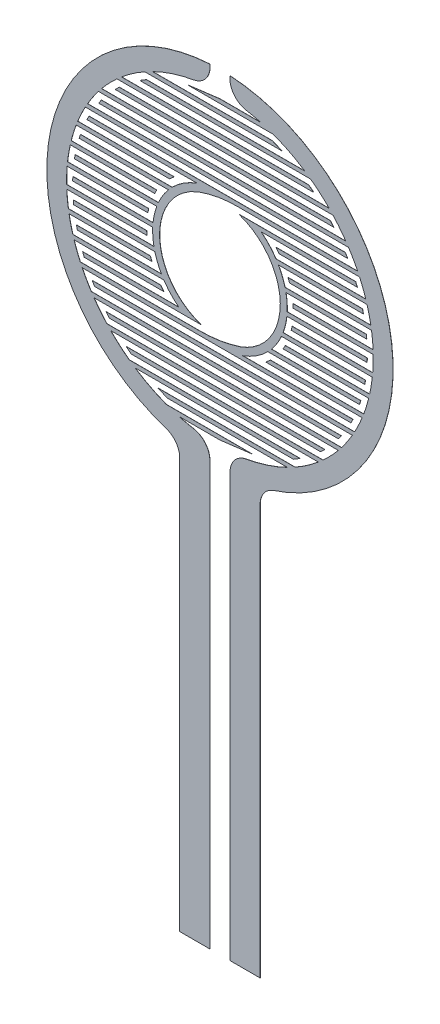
SolidWorks part; units mm, degrees
ref_plane "Front Plane" through (0, 0, 0) normal (0, 0, 1) x (1, 0, 0)
ref_plane "Top Plane" through (0, 0, 0) normal (0, 1, 0) x (1, 0, 0)
ref_plane "Right Plane" through (0, 0, 0) normal (1, 0, 0) x (0, 0, -1)
sketch "Sketch1" plane through (0, 0, 0) normal (0, 0, 1) x (1, 0, 0)
  line L0 (-1.0555, -3.2004) -> (-7.0583, -3.2004)
  line L557 (-0.508, -29.9998) -> (-0.508, -8.6191)
  line L558 (-2.0737, -7.4674) -> (0, -7.4674)
  line L559 (0, -7.4674) -> (1.6299, -7.2644)
  line L560 (1.6299, -7.2644) -> (-2.7002, -7.2644)
  line L561 (-4.2944, -6.4514) -> (3.7158, -6.4514)
  line L562 (4.0479, -6.2484) -> (-4.5848, -6.2484)
  line L563 (-5.5244, -5.4354) -> (5.0877, -5.4354)
  line L564 (5.2962, -5.2324) -> (-5.717, -5.2324)
  line L565 (-6.3664, -4.4194) -> (5.9914, -4.4194)
  line L566 (6.136, -4.2164) -> (-6.5027, -4.2164)
  line L567 (-6.9627, -3.4034) -> (6.6215, -3.4034)
  line L568 (6.6215, -3.4034) -> (6.722, -3.2004)
  line L569 (6.722, -3.2004) -> (1.1478, -3.2004)
  line L570 (2.4208, -2.3874) -> (7.0518, -2.3874)
  line L571 (7.0518, -2.3874) -> (7.1173, -2.1844)
  line L572 (7.1173, -2.1844) -> (2.6055, -2.1844)
  line L573 (3.1112, -1.3714) -> (7.3176, -1.3714)
  line L574 (7.3176, -1.3714) -> (7.3527, -1.1684)
  line L575 (7.3527, -1.1684) -> (3.1929, -1.1684)
  line L576 (3.3814, -0.3554) -> (7.4365, -0.3554)
  line L577 (7.4365, -0.3554) -> (7.4434, -0.1524)
  line L578 (7.4434, -0.1524) -> (3.3966, -0.1524)
  line L579 (3.3352, 0.6604) -> (7.4157, 0.6604)
  line L580 (7.4157, 0.6604) -> (7.3948, 0.8634)
  line L581 (7.3948, 0.8634) -> (3.2885, 0.8634)
  line L582 (2.958, 1.6764) -> (7.2538, 1.6764)
  line L583 (7.2538, 1.6764) -> (7.2039, 1.8794)
  line L584 (7.2039, 1.8794) -> (2.8333, 1.8794)
  line L585 (2.0763, 2.6924) -> (6.9411, 2.6924)
  line L586 (6.9411, 2.6924) -> (6.8589, 2.8954)
  line L587 (6.8589, 2.8954) -> (0.9587, 2.8954)
  line L590 (-7.3731, -2.3874) -> (-2.8333, -2.3874)
  line L591 (-2.9926, -2.1844) -> (-7.4358, -2.1844)
  line L592 (-7.6277, -1.3714) -> (-3.4418, -1.3714)
  line L593 (-3.5159, -1.1684) -> (-7.6614, -1.1684)
  line L594 (-7.7418, -0.3554) -> (-3.6879, -0.3554)
  line L595 (-3.7019, -0.1524) -> (-7.7485, -0.1524)
  line L596 (-7.7218, 0.6604) -> (-3.6457, 0.6604)
  line L597 (-3.603, 0.8634) -> (-7.7018, 0.8634)
  line L598 (-7.5665, 1.6764) -> (-3.304, 1.6764)
  line L599 (-3.1929, 1.8794) -> (-7.5187, 1.8794)
  line L600 (-7.2673, 2.6924) -> (-2.5452, 2.6924)
  line L601 (-2.3116, 2.8954) -> (-7.1888, 2.8954)
  line L602 (-6.8052, 3.7084) -> (6.4557, 3.7084)
  line L603 (6.4557, 3.7084) -> (6.3347, 3.9114)
  line L604 (6.3347, 3.9114) -> (-6.6905, 3.9114)
  line L605 (-6.1435, 4.7244) -> (5.754, 4.7244)
  line L606 (5.5811, 4.9274) -> (-5.9819, 4.9274)
  line L607 (-5.2068, 5.7404) -> (4.7409, 5.7404)
  line L608 (4.4838, 5.9434) -> (-4.9738, 5.9434)
  line L609 (-3.7965, 6.7564) -> (3.1272, 6.7564)
  line L610 (2.6448, 6.9594) -> (-3.4102, 6.9594)
  line L611 (-0.5, 8.6205) -> (-0.5, 8.7357)
  line L612 (-2.032, -9.2666) -> (-2.032, -29.9998)
  line L613 (-2.032, -29.9998) -> (-0.508, -29.9998)
  line L614 (0.508, -29.9998) -> (0.508, -8.6191)
  line L615 (3.4102, -6.9594) -> (-2.6448, -6.9594)
  line L616 (-3.1272, -6.7564) -> (3.7965, -6.7564)
  line L617 (4.9738, -5.9434) -> (-4.4838, -5.9434)
  line L618 (-4.7409, -5.7404) -> (5.2068, -5.7404)
  line L619 (5.9819, -4.9274) -> (-5.5811, -4.9274)
  line L620 (-5.754, -4.7244) -> (6.1435, -4.7244)
  line L621 (6.6905, -3.9114) -> (-6.3347, -3.9114)
  line L622 (-6.3347, -3.9114) -> (-6.4557, -3.7084)
  line L623 (-6.4557, -3.7084) -> (6.8052, -3.7084)
  line L624 (7.1888, -2.8954) -> (2.3116, -2.8954)
  line L625 (2.5452, -2.6924) -> (7.2673, -2.6924)
  line L626 (7.5187, -1.8794) -> (3.1929, -1.8794)
  line L627 (3.304, -1.6764) -> (7.5665, -1.6764)
  line L628 (7.7018, -0.8634) -> (3.603, -0.8634)
  line L629 (3.6457, -0.6604) -> (7.7218, -0.6604)
  line L630 (7.7485, 0.1524) -> (3.7019, 0.1524)
  line L631 (3.6879, 0.3554) -> (7.7418, 0.3554)
  line L632 (7.6614, 1.1684) -> (3.5159, 1.1684)
  line L633 (3.4418, 1.3714) -> (7.6277, 1.3714)
  line L634 (7.4358, 2.1844) -> (2.9926, 2.1844)
  line L635 (2.8333, 2.3874) -> (7.3731, 2.3874)
  line L636 (7.0583, 3.2004) -> (0.9587, 3.2004)
  line L637 (-0.9587, -2.8954) -> (-6.8589, -2.8954)
  line L638 (-6.8589, -2.8954) -> (-6.9411, -2.6924)
  line L639 (-6.9411, -2.6924) -> (-2.0763, -2.6924)
  line L640 (-2.8333, -1.8794) -> (-7.2039, -1.8794)
  line L641 (-7.2039, -1.8794) -> (-7.2538, -1.6764)
  line L642 (-7.2538, -1.6764) -> (-2.958, -1.6764)
  line L643 (-3.2885, -0.8634) -> (-7.3948, -0.8634)
  line L644 (-7.3948, -0.8634) -> (-7.4157, -0.6604)
  line L645 (-7.4157, -0.6604) -> (-3.3352, -0.6604)
  line L646 (-3.3966, 0.1524) -> (-7.4434, 0.1524)
  line L647 (-7.4434, 0.1524) -> (-7.4365, 0.3554)
  line L648 (-7.4365, 0.3554) -> (-3.3814, 0.3554)
  line L649 (-3.1929, 1.1684) -> (-7.3527, 1.1684)
  line L650 (-7.3527, 1.1684) -> (-7.3176, 1.3714)
  line L651 (-7.3176, 1.3714) -> (-3.1112, 1.3714)
  line L652 (-2.6055, 2.1844) -> (-7.1173, 2.1844)
  line L653 (-7.1173, 2.1844) -> (-7.0518, 2.3874)
  line L654 (-7.0518, 2.3874) -> (-2.4208, 2.3874)
  line L655 (-1.1478, 3.2004) -> (-6.722, 3.2004)
  line L656 (-6.722, 3.2004) -> (-6.6215, 3.4034)
  line L657 (-6.6215, 3.4034) -> (6.9627, 3.4034)
  line L658 (6.5027, 4.2164) -> (-6.136, 4.2164)
  line L659 (-5.9914, 4.4194) -> (6.3664, 4.4194)
  line L660 (5.717, 5.2324) -> (-5.2962, 5.2324)
  line L661 (-5.0877, 5.4354) -> (5.5244, 5.4354)
  line L662 (4.5848, 6.2484) -> (-4.0479, 6.2484)
  line L663 (-3.7158, 6.4514) -> (4.2944, 6.4514)
  line L664 (2.7002, 7.2644) -> (-1.6299, 7.2644)
  line L665 (-1.6299, 7.2644) -> (0, 7.4674)
  line L666 (0, 7.4674) -> (2.0737, 7.4674)
  line L667 (0.5, 8.6205) -> (0.5, 8.7357)
  line L668 (2.032, -9.2666) -> (2.032, -29.9998)
  line L669 (2.032, -29.9998) -> (0.508, -29.9998)
  arc A177 (-0.508, -8.6191) -> (-1.3357, -7.634) centre (-1.508, -8.6191) ccw
  arc A178 (-2.0737, -7.4674) -> (-1.3357, -7.634) centre (0, 0) ccw
  arc A179 (-4.2944, -6.4514) -> (-2.7002, -7.2644) centre (0, 0) ccw
  arc A180 (3.7158, -6.4514) -> (4.0479, -6.2484) centre (0, 0) ccw
  arc A181 (-5.5244, -5.4354) -> (-4.5848, -6.2484) centre (0, 0) ccw
  arc A182 (5.0877, -5.4354) -> (5.2962, -5.2324) centre (0, 0) ccw
  arc A183 (-6.3664, -4.4194) -> (-5.717, -5.2324) centre (0, 0) ccw
  arc A184 (5.9914, -4.4194) -> (6.136, -4.2164) centre (0, 0) ccw
  arc A185 (-6.9627, -3.4034) -> (-6.5027, -4.2164) centre (0, 0) ccw
  arc A186 (1.1478, -3.2004) -> (2.4208, -2.3874) centre (0, 0) ccw
  arc A187 (2.6055, -2.1844) -> (3.1112, -1.3714) centre (0, 0) ccw
  arc A188 (3.1929, -1.1684) -> (3.3814, -0.3554) centre (0, 0) ccw
  arc A189 (3.3966, -0.1524) -> (3.3352, 0.6604) centre (0, 0) ccw
  arc A190 (3.2885, 0.8634) -> (2.958, 1.6764) centre (0, 0) ccw
  arc A191 (2.8333, 1.8794) -> (2.0763, 2.6924) centre (0, 0) ccw
  arc A192 (1.0296, -2.8709) -> (0.9587, 2.8954) centre (0, 0) ccw
  arc A193 (-1.0555, -3.2004) -> (1.0296, -2.8709) centre (-1.0071, 3.2566) ccw
  arc A194 (-7.3731, -2.3874) -> (-7.0583, -3.2004) centre (0, 0) ccw
  arc A195 (-2.9926, -2.1844) -> (-2.8333, -2.3874) centre (0, 0) ccw
  arc A196 (-7.6277, -1.3714) -> (-7.4358, -2.1844) centre (0, 0) ccw
  arc A197 (-3.5159, -1.1684) -> (-3.4418, -1.3714) centre (0, 0) ccw
  arc A198 (-7.7418, -0.3554) -> (-7.6614, -1.1684) centre (0, 0) ccw
  arc A199 (-3.7019, -0.1524) -> (-3.6879, -0.3554) centre (0, 0) ccw
  arc A200 (-7.7218, 0.6604) -> (-7.7485, -0.1524) centre (0, 0) ccw
  arc A201 (-3.603, 0.8634) -> (-3.6457, 0.6604) centre (0, 0) ccw
  arc A202 (-7.5665, 1.6764) -> (-7.7018, 0.8634) centre (0, 0) ccw
  arc A203 (-3.1929, 1.8794) -> (-3.304, 1.6764) centre (0, 0) ccw
  arc A204 (-7.2673, 2.6924) -> (-7.5187, 1.8794) centre (0, 0) ccw
  arc A205 (-2.3116, 2.8954) -> (-2.5452, 2.6924) centre (0, 0) ccw
  arc A206 (-6.8052, 3.7084) -> (-7.1888, 2.8954) centre (0, 0) ccw
  arc A207 (-6.1435, 4.7244) -> (-6.6905, 3.9114) centre (0, 0) ccw
  arc A208 (5.754, 4.7244) -> (5.5811, 4.9274) centre (0, 0) ccw
  arc A209 (-5.2068, 5.7404) -> (-5.9819, 4.9274) centre (0, 0) ccw
  arc A210 (4.7409, 5.7404) -> (4.4838, 5.9434) centre (0, 0) ccw
  arc A211 (-3.7965, 6.7564) -> (-4.9738, 5.9434) centre (0, 0) ccw
  arc A212 (3.1272, 6.7564) -> (2.6448, 6.9594) centre (0, 0) ccw
  arc A213 (-1.3286, 7.6353) -> (-3.4102, 6.9594) centre (0, 0) ccw
  arc A214 (-1.3286, 7.6353) -> (-0.5, 8.6205) centre (-1.5, 8.6205) ccw
  arc A215 (-0.5, 8.7357) -> (-2.721, -8.3162) centre (0, 0) ccw
  arc A216 (-2.032, -9.2666) -> (-2.721, -8.3162) centre (-3.032, -9.2666) ccw
  arc A217 (1.3357, -7.634) -> (0.508, -8.6191) centre (1.508, -8.6191) ccw
  arc A218 (1.3357, -7.634) -> (3.4102, -6.9594) centre (0, 0) ccw
  arc A219 (-3.1272, -6.7564) -> (-2.6448, -6.9594) centre (0, 0) ccw
  arc A220 (3.7965, -6.7564) -> (4.9738, -5.9434) centre (0, 0) ccw
  arc A221 (-4.7409, -5.7404) -> (-4.4838, -5.9434) centre (0, 0) ccw
  arc A222 (5.2068, -5.7404) -> (5.9819, -4.9274) centre (0, 0) ccw
  arc A223 (-5.754, -4.7244) -> (-5.5811, -4.9274) centre (0, 0) ccw
  arc A224 (6.1435, -4.7244) -> (6.6905, -3.9114) centre (0, 0) ccw
  arc A225 (6.8052, -3.7084) -> (7.1888, -2.8954) centre (0, 0) ccw
  arc A226 (2.3116, -2.8954) -> (2.5452, -2.6924) centre (0, 0) ccw
  arc A227 (7.2673, -2.6924) -> (7.5187, -1.8794) centre (0, 0) ccw
  arc A228 (3.1929, -1.8794) -> (3.304, -1.6764) centre (0, 0) ccw
  arc A229 (7.5665, -1.6764) -> (7.7018, -0.8634) centre (0, 0) ccw
  arc A230 (3.603, -0.8634) -> (3.6457, -0.6604) centre (0, 0) ccw
  arc A231 (7.7218, -0.6604) -> (7.7485, 0.1524) centre (0, 0) ccw
  arc A232 (3.7019, 0.1524) -> (3.6879, 0.3554) centre (0, 0) ccw
  arc A233 (7.7418, 0.3554) -> (7.6614, 1.1684) centre (0, 0) ccw
  arc A234 (3.5159, 1.1684) -> (3.4418, 1.3714) centre (0, 0) ccw
  arc A235 (7.6277, 1.3714) -> (7.4358, 2.1844) centre (0, 0) ccw
  arc A236 (2.9926, 2.1844) -> (2.8333, 2.3874) centre (0, 0) ccw
  arc A237 (7.3731, 2.3874) -> (7.0583, 3.2004) centre (0, 0) ccw
  arc A238 (0.9587, 3.2004) -> (-1.0296, 2.8709) centre (0.8552, -2.3398) ccw
  arc A239 (-1.0296, 2.8709) -> (-1.5303, 2.6383) centre (1.4659, -3.1548) ccw
  arc A240 (-1.5303, 2.6383) -> (-0.9587, -2.8954) centre (0, 0) ccw
  arc A241 (-2.8333, -1.8794) -> (-2.0763, -2.6924) centre (0, 0) ccw
  arc A242 (-3.2885, -0.8634) -> (-2.958, -1.6764) centre (0, 0) ccw
  arc A243 (-3.3966, 0.1524) -> (-3.3352, -0.6604) centre (0, 0) ccw
  arc A244 (-3.1929, 1.1684) -> (-3.3814, 0.3554) centre (0, 0) ccw
  arc A245 (-2.6055, 2.1844) -> (-3.1112, 1.3714) centre (0, 0) ccw
  arc A246 (-1.1478, 3.2004) -> (-2.4208, 2.3874) centre (0, 0) ccw
  arc A247 (6.9627, 3.4034) -> (6.5027, 4.2164) centre (0, 0) ccw
  arc A248 (-5.9914, 4.4194) -> (-6.136, 4.2164) centre (0, 0) ccw
  arc A249 (6.3664, 4.4194) -> (5.717, 5.2324) centre (0, 0) ccw
  arc A250 (-5.0877, 5.4354) -> (-5.2962, 5.2324) centre (0, 0) ccw
  arc A251 (5.5244, 5.4354) -> (4.5848, 6.2484) centre (0, 0) ccw
  arc A252 (-3.7158, 6.4514) -> (-4.0479, 6.2484) centre (0, 0) ccw
  arc A253 (4.2944, 6.4514) -> (2.7002, 7.2644) centre (0, 0) ccw
  arc A254 (2.0737, 7.4674) -> (1.3286, 7.6353) centre (0, 0) ccw
  arc A255 (0.5, 8.6205) -> (1.3286, 7.6353) centre (1.5, 8.6205) ccw
  arc A256 (2.721, -8.3162) -> (0.5, 8.7357) centre (0, 0) ccw
  arc A257 (2.721, -8.3162) -> (2.032, -9.2666) centre (3.032, -9.2666) ccw
extrude "Boss-Extrude1" add sketch "Sketch1" along normal blind 0.007
